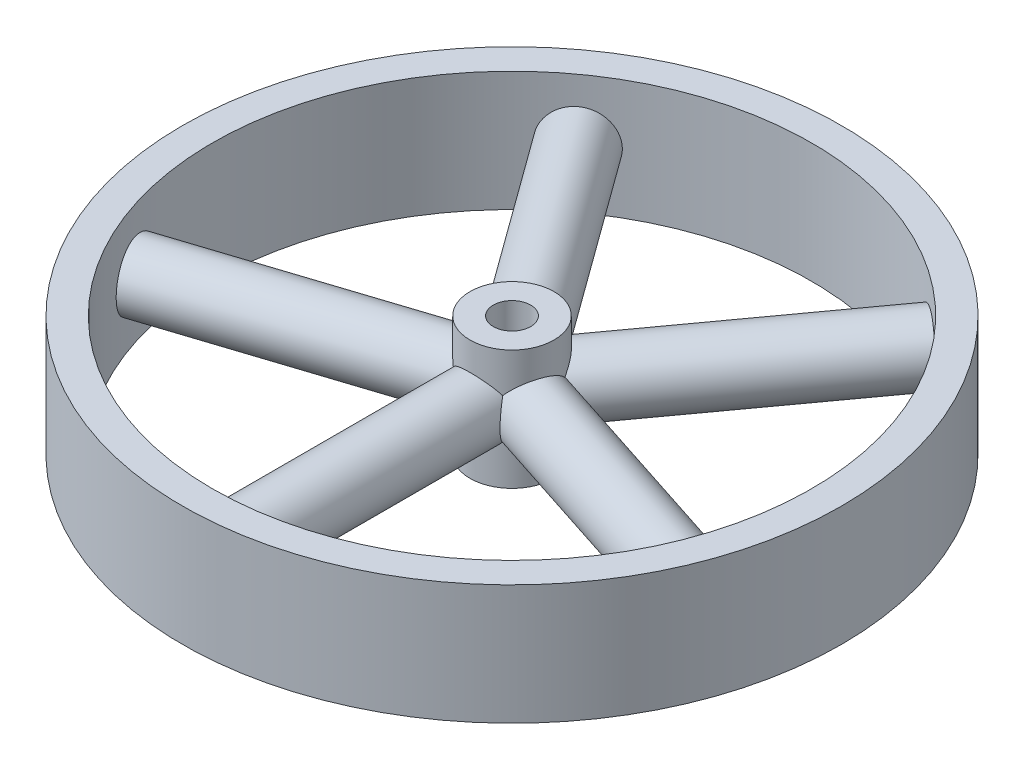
SolidWorks part; units mm, degrees
ref_plane "Front Plane" through (0, 0, 0) normal (0, 0, 1) x (1, 0, 0)
ref_plane "Top Plane" through (0, 0, 0) normal (0, 1, 0) x (1, 0, 0)
ref_plane "Right Plane" through (0, 0, 0) normal (1, 0, 0) x (0, 0, -1)
sketch "Sketch1" plane through (0, 0, 0) normal (0, 1, 0) x (1, 0, 0)
  circle A0 centre (0, 0) radius 63.5
  dimension "D1" = 127
extrude "Extrude-Thin1" add sketch "Sketch1" along normal mid plane 25.4 thin
sketch "Sketch2" plane through (0, 0, 0) normal (0, 1, 0) x (1, 0, 0)
  circle A0 centre (0, 0) radius 8.8951
sketch "Sketch3" plane through (0, 0, 0) normal (0, 0, 1) x (1, 0, 0)
  circle A0 centre (0, 0) radius 6.7451
extrude "Extrude2" add sketch "Sketch2" along normal mid plane 25.4
extrude "Extrude3" add sketch "Sketch3" along normal up to surface (63.1407 mm away)
pattern_circular "CirPattern2" count 5 over 360 about axis through (0, 12.7, 0) along (0, -1, 0) of "Extrude3"
sketch "Sketch4" plane through (0, 12.7, 0) normal (0, 1, 0) x (-1, 0, 0)
  circle A0 centre (0, 0) radius 3.9617
extrude "Cut-Extrude1" cut sketch "Sketch4" against normal through all
